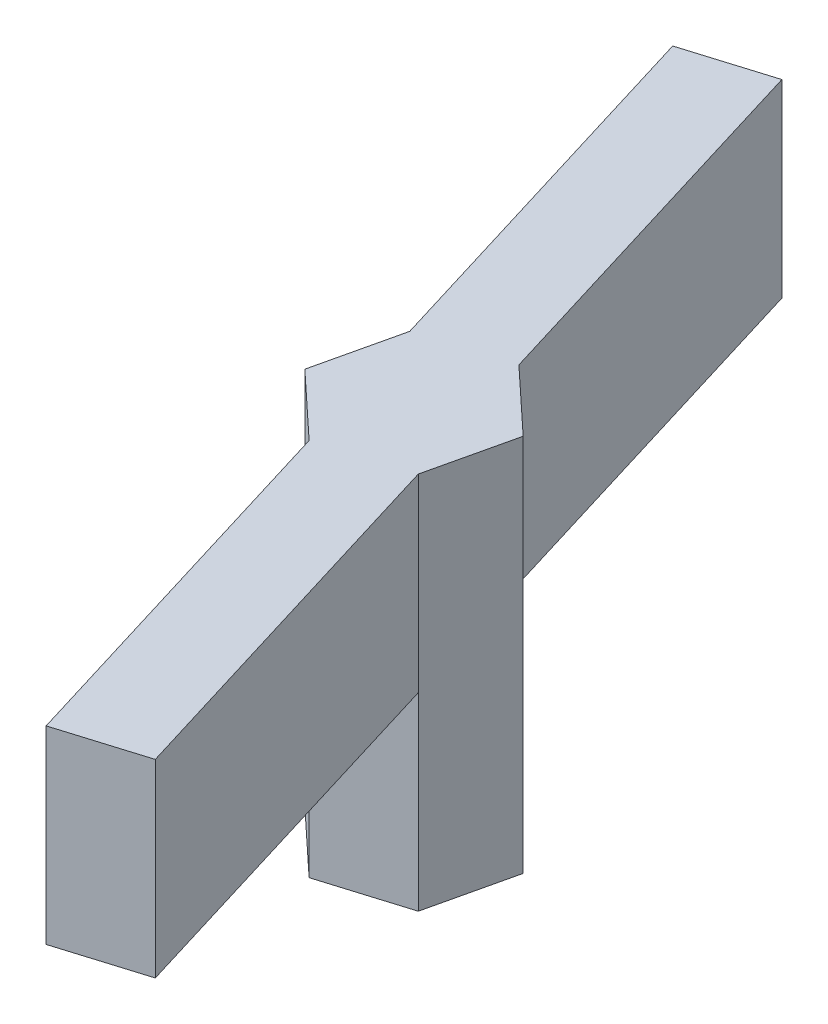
SolidWorks part; units mm, degrees
ref_plane "Front Plane" through (0, 0, 0) normal (0, 0, 1) x (1, 0, 0)
ref_plane "Top Plane" through (0, 0, 0) normal (0, 1, 0) x (1, 0, 0)
ref_plane "Right Plane" through (0, 0, 0) normal (1, 0, 0) x (0, 0, -1)
sketch "Sketch1" plane through (0, 0, 0) normal (0, 1, 0) x (1, 0, 0)
  line L1 (1.6885, -1.5755) -> (2.2087, 0.6745)
  line L2 (2.2087, 0.6745) -> (0.5202, 2.2501)
  line L3 (0.5202, 2.2501) -> (-1.6885, 1.5755)
  line L4 (-1.6885, 1.5755) -> (-2.2087, -0.6745)
  line L5 (-2.2087, -0.6745) -> (-0.5202, -2.2501)
  line L6 (-0.5202, -2.2501) -> (1.6885, -1.5755)
  circle A0 centre (0, 0) radius 2 construction
  dimension "D1" = 4
extrude "Boss-Extrude1" add sketch "Sketch1" along normal blind 5
sketch "Sketch2" plane through (0, 5, 0) normal (0, 1, 0) x (1, 0, 0)
  line L1 (-0.5202, -2.2501) -> (2.5339, -12.2501)
  line L2 (-1.6885, 1.5755) -> (-4.7426, 11.5755)
  line L3 (1.6885, -1.5755) -> (4.7426, -11.5755)
  line L4 (4.7426, -11.5755) -> (2.5339, -12.2501)
  line L5 (-4.7426, 11.5755) -> (-2.5339, 12.2501)
  line L6 (-2.5339, 12.2501) -> (0.5202, 2.2501)
  line L9 (0.5202, 2.2501) -> (2.2087, 0.6745)
  line L10 (2.2087, 0.6745) -> (1.6885, -1.5755)
  line L11 (-1.6885, 1.5755) -> (-2.2087, -0.6745)
  line L12 (-2.2087, -0.6745) -> (-0.5202, -2.2501)
  dimension "D1" = 10
  dimension "D2" = 10
extrude "Boss-Extrude3" add sketch "Sketch2" along normal blind 5 contours L2 L5 L6 L9 L10 L3 L4 L1 L12 L11
